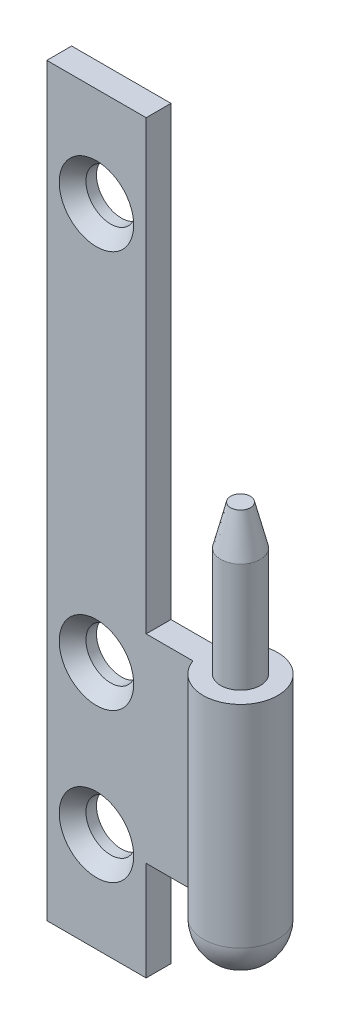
SolidWorks part; units mm, degrees
ref_plane "Plan de face" through (0, 0, 0) normal (0, 0, 1) x (1, 0, 0)
ref_plane "Plan de dessus" through (0, 0, 0) normal (0, 1, 0) x (1, 0, 0)
ref_plane "Plan de droite" through (0, 0, 0) normal (1, 0, 0) x (0, 0, -1)
sketch "Esquisse1" plane through (0, 0, 0) normal (0, 0, 1) x (1, 0, 0)
  line L1 (0, 0) -> (20, 0)
  line L2 (0, 0) -> (0, 150)
  line L3 (0, 150) -> (20, 150)
  line L4 (20, 0) -> (20, 150)
  dimension "D1" = 20
  dimension "D2" = 150
extrude "Boss.-Extru.1" add sketch "Esquisse1" along normal mid plane 5
sketch "Esquisse2" plane through (20, 0, 0) normal (1, 0, 0) x (0, 0, -1)
  line L0 (-2.5, 0) -> (-2.5, 150) construction
  line L1 (-2.5, 20) -> (2.5, 20)
  line L2 (-2.5, 20) -> (-2.5, 60)
  line L3 (-2.5, 60) -> (2.5, 60)
  line L4 (2.5, 20) -> (2.5, 60)
  line L5 (2.5, 0) -> (2.5, 150) construction
  line L6 (-2.5, 0) -> (2.5, 0) construction
  point P8 (0, 0)
  dimension "D1" = 20
  dimension "D2" = 40
extrude "Boss.-Extru.2" add sketch "Esquisse2" along normal blind 10
sketch "Esquisse3" plane through (0, 0, 0) normal (0, 0, 1) x (1, 0, 0)
  line L0 (36.5, 90) -> (36.5, 10) construction
  line L1 (36.5, 90) -> (32.5, 90)
  line L2 (32.5, 90) -> (32.5, 60)
  line L3 (32.5, 60) -> (29, 60)
  line L4 (29, 60) -> (29, 17.5)
  line L5 (0, 0) -> (20, 0) construction
  line L6 (30, 60) -> (30, 20) construction
  line L7 (30, 60) -> (20, 60) construction
  line L8 (36.5, 90) -> (36.5, 10)
  arc A0 (29, 17.5) -> (36.5, 10) centre (36.5, 17.5) ccw
  dimension "D1" = 15
  dimension "D2" = 10
  dimension "D3" = 1
  dimension "D4" = 80
  dimension "D5" = 8
revolve "Révolution1" add sketch "Esquisse3" angle 360 about L0
chamfer "Chanfrein1" distance 8 distance2 2 1 edges at (32.5, 90, 0)
hole_wizard "Perçage1" positions "Esquisse5" profile "Esquisse4" legacy
sketch "Esquisse5" plane through (0, 0, 2.5) normal (0, 0, 1) x (1, 0, 0)
  line L0 (10, 130) -> (10, 20) construction
  line L2 (20, 60) -> (20, 150) construction
  line L3 (0, 150) -> (0, 0) construction
  line L4 (20, 150) -> (0, 150) construction
  line L5 (0, 0) -> (20, 0) construction
  point P0 (10, 20)
  point P1 (10, 50)
  point P3 (10, 130)
  dimension "D1" = 20
  dimension "D2" = 20
  dimension "D3" = 50
sketch "Esquisse4" plane through (10, 20, 2.5) normal (1, 0, 0) x (0, -1, 0)
  line L0 (0, 0) -> (0, 13.0043)
  line L1 (0, 13.0043) -> (5, 10)
  line L2 (5, 10) -> (5, 2.8759)
  line L3 (5, 2.8759) -> (7.5, 0)
  line L4 (7.5, 0) -> (0, 0)
  line L5 (0, -14.3089) -> (0, 102.4216) construction
  line L6 (0, 13.0043) -> (-5, 10) construction
  line L7 (-5, 2.8759) -> (-7.5, 0) construction
  dimension "Diamètre" = 10
  dimension "Profondeur" = 10
  dimension "Diamètre fraisé" = 15
  dimension "Angle fraisé" = 82
  dimension "Angle" = 118
